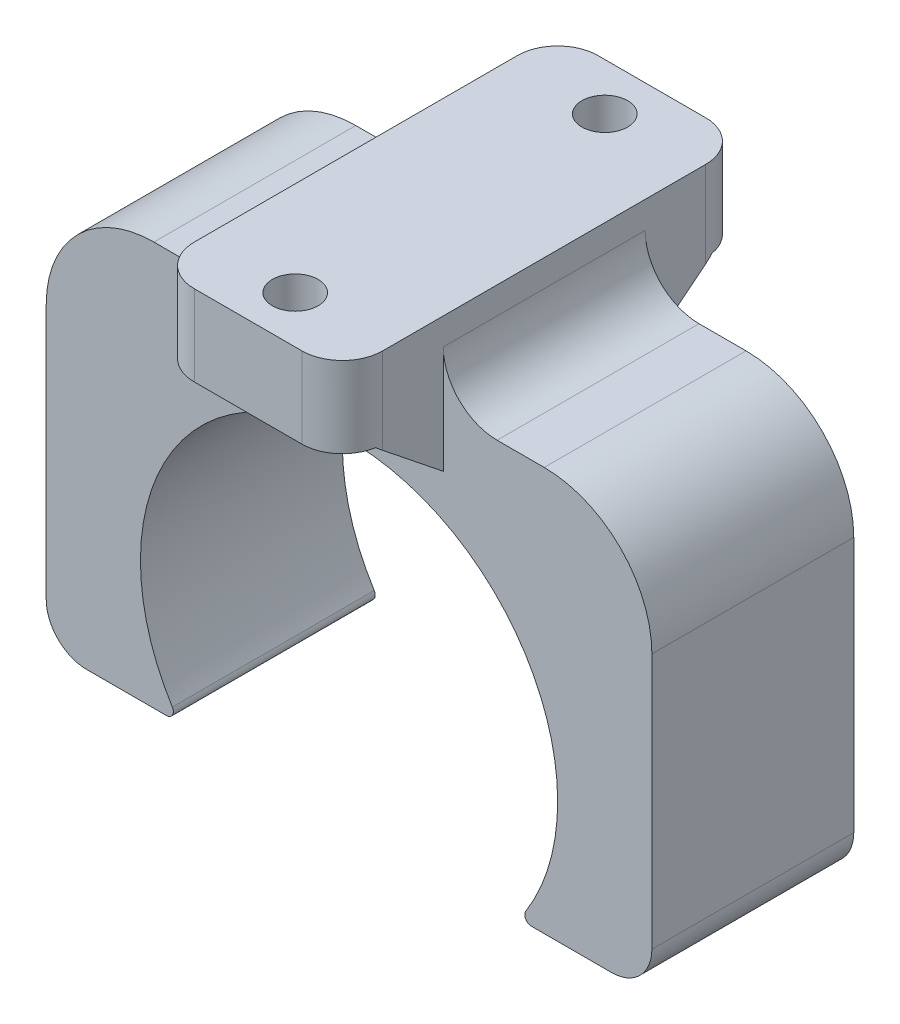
SolidWorks part; units mm, degrees
ref_plane "前视基准面" through (0, 0, 0) normal (0, 0, 1) x (1, 0, 0)
ref_plane "上视基准面" through (0, 0, 0) normal (0, 1, 0) x (1, 0, 0)
ref_plane "右视基准面" through (0, 0, 0) normal (1, 0, 0) x (0, 0, -1)
other "Configuration Table"
sketch "草图1" plane through (0, 0, 0) normal (0, 0, 1) x (1, 0, 0)
  line L1 (-22.5, -15) -> (22.5, -15)
  line L2 (-22.5, -15) -> (-22.5, 15)
  line L3 (-22.5, 15) -> (22.5, 15)
  line L4 (22.5, -15) -> (22.5, 15)
  line L5 (-22.5, -15) -> (22.5, 15) construction
  line L6 (-22.5, 15) -> (22.5, -15) construction
  point P0 (0, 0)
  dimension "D1" = 45
  dimension "D2" = 30
extrude "凸台-拉伸1" add sketch "草图1" along normal mid plane 15
sketch "草图2" plane through (0, 0, 7.5) normal (0, 0, 1) x (1, 0, 0)
  line L0 (0, 0) -> (0, -6) construction
  circle A0 centre (0, -6) radius 15.5
  dimension "D1" = 31
  dimension "D2" = 6
extrude "切除-拉伸1" cut sketch "草图2" against normal up to surface (15 mm away)
fillet "圆角1" radius 8 2 edges at (22.5, 15, 0) (-22.5, 15, 0)
fillet "圆角2" radius 3 2 edges at (-22.5, -15, 0) (22.5, -15, 0)
fillet "圆角3" radius 0.5 2 edges at (12.6194, -15, 0) (-12.6194, -15, 0)
sketch "草图4" plane through (0, 15, 0) normal (0, 1, 0) x (1, 0, 0)
  line L1 (-7, -15) -> (7, -15)
  line L2 (-7, -15) -> (-7, 15)
  line L3 (-7, 15) -> (7, 15)
  line L4 (7, -15) -> (7, 15)
  line L5 (-7, -15) -> (7, 15) construction
  line L6 (-7, 15) -> (7, -15) construction
  point P0 (0, 0)
  dimension "D1" = 14
  dimension "D2" = 30
extrude "凸台-拉伸2" add sketch "草图4" along normal blind 6
fillet "圆角5" radius 4 2 edges at (7, 15, 0) (-7, 15, 0)
ref_plane "基准面1" through (6, 0, 0) normal (1, 0, 0) x (0, 0, -1)
sketch "草图5" plane through (6, 0, 0) normal (1, 0, 0) x (0, 0, -1)
  line L0 (-12.5, 15) -> (-7.5, 11)
  line L1 (-15, 15) -> (-7.5, 15) construction
  line L2 (-7.5, 15) -> (-7.5, 7) construction
  dimension "D1" = 5
rib "筋1" sketch "草图5" sketch "草图5" thickness 2 extrusion direction parallel to sketch draft on no parameters "D1"=2
mirror "镜向1" about plane through (0, 0, 0) normal (0, 0, 1) of "筋1"
mirror "镜向2" about plane through (0, 0, 0) normal (1, 0, 0) of "筋1", "镜向1"
sketch "草图7" plane through (0, 15, 0) normal (0, -1, 0) x (1, 0, 0)
  line L0 (0, -11.5) -> (0, 11.5) construction
  circle A0 centre (0, 11.5) radius 1.7
  circle A1 centre (0, -11.5) radius 1.7
  dimension "D1" = 3.4
  dimension "D2" = 23
extrude "切除-拉伸2" cut sketch "草图7" against normal up to surface (6 mm away)
fillet "圆角6" radius 3 4 edges at (7, 18, 15) (-7, 18, 15) (7, 18, -15) (-7, 18, -15)
